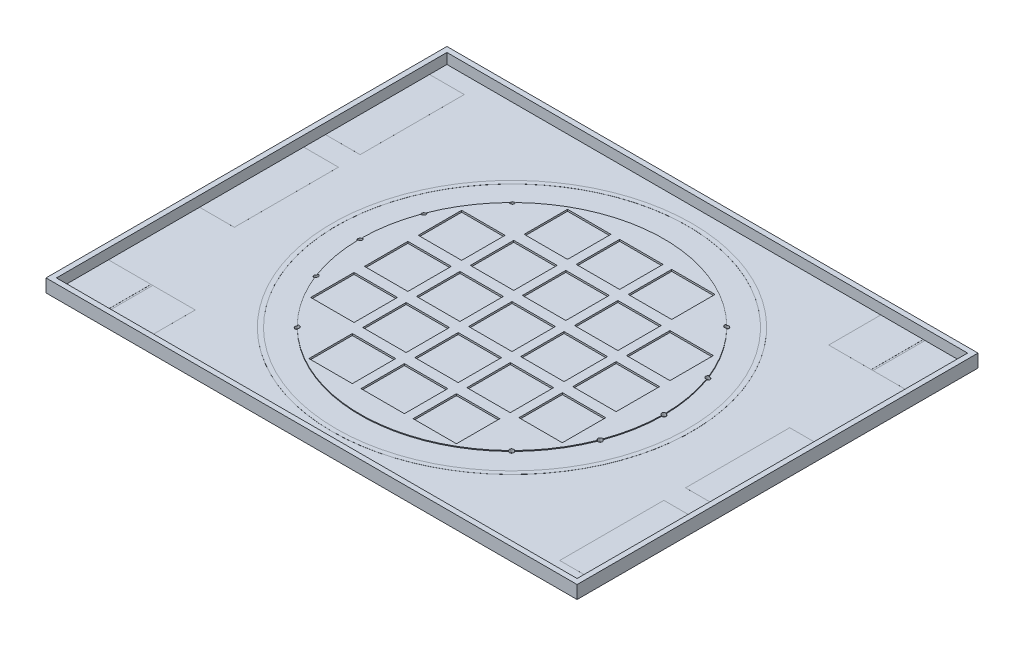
SolidWorks part; units mm, degrees
ref_plane "Front Plane" through (0, 0, 0) normal (0, 0, 1) x (1, 0, 0)
ref_plane "Top Plane" through (0, 0, 0) normal (0, 1, 0) x (1, 0, 0)
ref_plane "Right Plane" through (0, 0, 0) normal (1, 0, 0) x (0, 0, -1)
sketch "Sketch1" plane through (0, 0, 0) normal (0, 1, 0) x (1, 0, 0)
  line L1 (3060, -2310) -> (-3060, -2310)
  line L2 (3060, -2310) -> (3060, 2310)
  line L3 (3060, 2310) -> (-3060, 2310)
  line L4 (-3060, -2310) -> (-3060, 2310)
  line L5 (3060, -2310) -> (-3060, 2310) construction
  line L6 (3060, 2310) -> (-3060, -2310) construction
  point P0 (0, 0)
  dimension "D1" = 4620
  dimension "D2" = 6120
extrude "Boss-Extrude1" add sketch "Sketch1" along normal blind 30
sketch "Sketch2" plane through (0, 30, 0) normal (0, 1, 0) x (1, 0, 0)
  line L0 (3060, -2310) -> (3060, 2310) construction
  line L1 (-3060, -2310) -> (3060, -2310) construction
  line L2 (-3060, 2310) -> (-3060, -2310) construction
  line L3 (3060, 2310) -> (-3060, 2310) construction
  line L4 (3060, -2310) -> (3060, 2310)
  line L5 (-3060, -2310) -> (3060, -2310)
  line L6 (-3060, 2310) -> (-3060, -2310)
  line L7 (3060, 2310) -> (-3060, 2310)
  line L8 (3000, 2250) -> (-3000, 2250)
  line L9 (-3000, 2250) -> (-3000, -2250)
  line L10 (-3000, -2250) -> (3000, -2250)
  line L11 (3000, -2250) -> (3000, 2250)
  dimension "D1" = 60
extrude "Boss-Extrude2" add sketch "Sketch2" along normal blind 120
sketch "Sketch3" plane through (0, 30, 0) normal (0, 1, 0) x (1, 0, 0)
  circle A0 centre (0, 0) radius 1750
  dimension "D1" = 3500
extrude "Boss-Extrude3" add sketch "Sketch3" along normal blind 10
sketch "Sketch4" plane through (0, 40, 0) normal (0, 1, 0) x (1, 0, 0)
  line L0 (0, 1750) -> (0, -1750) construction
  line L1 (350, -250) -> (850, -250)
  line L2 (-250, -250) -> (250, -250)
  line L3 (-250, -250) -> (-250, 250)
  line L4 (-250, 250) -> (250, 250)
  line L5 (250, -250) -> (250, 250)
  line L6 (-250, -250) -> (250, 250) construction
  line L7 (-250, 250) -> (250, -250) construction
  line L8 (350, -250) -> (350, 250)
  line L9 (350, 250) -> (850, 250)
  line L10 (850, -250) -> (850, 250)
  line L11 (950, -250) -> (1450, -250)
  line L12 (950, -250) -> (950, 250)
  line L13 (950, 250) -> (1450, 250)
  line L14 (1450, -250) -> (1450, 250)
  line L15 (-1450, -250) -> (-1450, 250)
  line L16 (-950, 250) -> (-1450, 250)
  line L17 (-950, -250) -> (-950, 250)
  line L18 (-950, -250) -> (-1450, -250)
  line L19 (-850, -250) -> (-850, 250)
  line L20 (-350, 250) -> (-850, 250)
  line L21 (-350, -250) -> (-350, 250)
  line L22 (-350, -250) -> (-850, -250)
  line L23 (-250, 870) -> (250, 870)
  line L24 (250, 370) -> (250, 870)
  line L25 (-250, 370) -> (250, 370)
  line L26 (-250, 370) -> (-250, 870)
  line L27 (-350, 870) -> (-850, 870)
  line L28 (-350, 370) -> (-350, 870)
  line L29 (-350, 370) -> (-850, 370)
  line L30 (-850, 370) -> (-850, 870)
  line L31 (350, 870) -> (850, 870)
  line L32 (350, 370) -> (350, 870)
  line L33 (350, 370) -> (850, 370)
  line L34 (850, 370) -> (850, 870)
  line L35 (-250, 1490) -> (250, 1490)
  line L36 (250, 990) -> (250, 1490)
  line L37 (-250, 990) -> (250, 990)
  line L38 (-250, 990) -> (-250, 1490)
  line L39 (-350, 1490) -> (-850, 1490)
  line L40 (-350, 990) -> (-350, 1490)
  line L41 (-350, 990) -> (-850, 990)
  line L42 (-850, 990) -> (-850, 1490)
  line L43 (350, 1490) -> (850, 1490)
  line L44 (350, 990) -> (350, 1490)
  line L45 (350, 990) -> (850, 990)
  line L46 (850, 990) -> (850, 1490)
  line L47 (-1750, 0) -> (1750, 0) construction
  line L48 (850, -990) -> (850, -1490)
  line L49 (350, -990) -> (850, -990)
  line L50 (350, -990) -> (350, -1490)
  line L51 (350, -1490) -> (850, -1490)
  line L52 (-850, -990) -> (-850, -1490)
  line L53 (-350, -990) -> (-850, -990)
  line L54 (-350, -990) -> (-350, -1490)
  line L55 (-350, -1490) -> (-850, -1490)
  line L56 (-250, -990) -> (-250, -1490)
  line L57 (-250, -990) -> (250, -990)
  line L58 (250, -990) -> (250, -1490)
  line L59 (-250, -1490) -> (250, -1490)
  line L60 (850, -370) -> (850, -870)
  line L61 (350, -370) -> (850, -370)
  line L62 (350, -370) -> (350, -870)
  line L63 (350, -870) -> (850, -870)
  line L64 (-850, -370) -> (-850, -870)
  line L65 (-350, -370) -> (-850, -370)
  line L66 (-350, -370) -> (-350, -870)
  line L67 (-350, -870) -> (-850, -870)
  line L68 (-250, -370) -> (-250, -870)
  line L69 (-250, -370) -> (250, -370)
  line L70 (250, -370) -> (250, -870)
  line L71 (-250, -870) -> (250, -870)
  line L72 (-950, 870) -> (-1450, 870)
  line L73 (-1450, 370) -> (-1450, 870)
  line L74 (-950, 370) -> (-1450, 370)
  line L75 (-950, 370) -> (-950, 870)
  line L76 (950, 870) -> (1450, 870)
  line L77 (950, 370) -> (950, 870)
  line L78 (950, 370) -> (1450, 370)
  line L79 (1450, 370) -> (1450, 870)
  line L80 (1450, -370) -> (1450, -870)
  line L81 (950, -370) -> (1450, -370)
  line L82 (950, -370) -> (950, -870)
  line L83 (950, -870) -> (1450, -870)
  line L84 (-950, -370) -> (-950, -870)
  line L85 (-950, -370) -> (-1450, -370)
  line L86 (-1450, -370) -> (-1450, -870)
  line L87 (-950, -870) -> (-1450, -870)
  circle A0 centre (0, 0) radius 1750 construction
  circle A1 centre (0, 0) radius 1750 construction
  point P7 (0, 0)
  dimension "D4" = 500
  dimension "D1" = 3
  dimension "D2" = 3
  dimension "D3" = 2
extrude "Cut-Extrude1" cut sketch "Sketch4" against normal blind 20
sketch "Sketch12" plane through (0, 30, 0) normal (0, 1, 0) x (1, 0, 0)
  circle A0 centre (0, 0) radius 2050 construction
  circle A1 centre (0, 0) radius 2075
  circle A2 centre (0, 0) radius 2025
  dimension "D1" = 25
  dimension "D3" = 4100
  dimension "D2" = 25
extrude "Boss-Extrude8" add sketch "Sketch12" along normal blind 1
sketch "Sketch13" plane through (0, 30, 0) normal (0, 1, 0) x (1, 0, 0)
  line L0 (-3000, 2250) -> (-3000, -2250) construction
  line L1 (-3000, -1650) -> (-2000, -1650)
  line L2 (-3000, -1650) -> (-3000, -2250)
  line L3 (-3000, -2250) -> (-2000, -2250)
  line L4 (-2000, -1650) -> (-2000, -2250)
  line L5 (-3000, -2250) -> (3000, -2250) construction
  line L6 (-3000, 0) -> (3000, 0) construction
  line L7 (3000, -2250) -> (3000, 2250) construction
  line L8 (3000, 2250) -> (-3000, 2250) construction
  line L9 (-3000, 600) -> (-2600, 600)
  line L10 (-3000, 600) -> (-3000, -600)
  line L11 (-3000, -600) -> (-2600, -600)
  line L12 (-2600, 600) -> (-2600, -600)
  line L13 (-3000, 2050) -> (-2600, 2050)
  line L14 (-3000, 2050) -> (-3000, 850)
  line L15 (-3000, 850) -> (-2600, 850)
  line L16 (-2600, 2050) -> (-2600, 850)
  line L29 (0, 2250) -> (0, -2250) construction
  line L30 (-3000, -2250) -> (3000, -2250) construction
  line L31 (3000, 1650) -> (2000, 1650)
  line L32 (3000, 1650) -> (3000, 2250)
  line L33 (3000, 2250) -> (2000, 2250)
  line L34 (2000, 1650) -> (2000, 2250)
  line L35 (3000, -600) -> (2600, -600)
  line L36 (3000, -600) -> (3000, 600)
  line L37 (3000, 600) -> (2600, 600)
  line L38 (2600, -600) -> (2600, 600)
  line L39 (3000, -2050) -> (2600, -2050)
  line L40 (3000, -2050) -> (3000, -850)
  line L41 (3000, -850) -> (2600, -850)
  line L42 (2600, -2050) -> (2600, -850)
  point P37 (0, 0)
  point P43 (0, 0)
  dimension "D1" = 1000
  dimension "D2" = 600
  dimension "D3" = 1200
  dimension "D4" = 400
  dimension "D5" = 400
  dimension "D6" = 1200
  dimension "D7" = 200
  dimension "D8" = 2
extrude "Boss-Extrude9" add sketch "Sketch13" along normal blind 0.1
sketch "Sketch14" plane through (0, 40, 0) normal (0, 1, 0) x (1, 0, 0)
  line L0 (-850, -1240) -> (-1234.8684, -1240) construction
  line L1 (-850, -990) -> (-850, -1490) construction
  line L2 (-1450, -620) -> (-1636.4901, -620) construction
  line L3 (-1450, -370) -> (-1450, -870) construction
  line L5 (0, 0) -> (-1234.8684, -1240) construction
  line L6 (0, 0) -> (-1636.4901, -620) construction
  line L7 (0, 0) -> (-1750, 0) construction
  line L8 (-1450, 620) -> (-1636.4901, 620) construction
  line L9 (-1450, 870) -> (-1450, 370) construction
  line L10 (-850, 1240) -> (-1234.8684, 1240) construction
  line L11 (-850, 1490) -> (-850, 990) construction
  line L12 (0, 2250) -> (0, -2250) construction
  line L13 (3000, 2250) -> (-3000, 2250) construction
  line L14 (-3000, -2250) -> (3000, -2250) construction
  line L15 (850, 1240) -> (1234.8684, 1240) construction
  line L16 (1450, 620) -> (1636.4901, 620) construction
  line L17 (1450, -620) -> (1636.4901, -620) construction
  line L18 (850, -1240) -> (1234.8684, -1240) construction
  circle A1 centre (-1636.4901, -620) radius 25
  circle A4 centre (0, 0) radius 1750 construction
  circle A5 centre (-1234.8684, -1240) radius 25
  circle A6 centre (0, 0) radius 1750 construction
  circle A7 centre (-1750, 0) radius 25
  circle A8 centre (-1636.4901, 620) radius 25
  circle A9 centre (-1234.8684, 1240) radius 25
  circle A10 centre (1234.8684, 1240) radius 25
  circle A11 centre (1636.4901, 620) radius 25
  circle A12 centre (1750, 0) radius 25
  circle A13 centre (1234.8684, -1240) radius 25
  circle A14 centre (1636.4901, -620) radius 25
  dimension "D1" = 50
extrude "Cut-Extrude2" cut sketch "Sketch14" against normal blind 40
sketch "Sketch15" plane through (0, 30.1, 0) normal (0, 1, 0) x (1, 0, 0)
  line L0 (-2500, -1650) -> (-2500, -2250) construction
  line L1 (-2000, -1650) -> (-3000, -1650) construction
  line L2 (-3000, -2250) -> (-2000, -2250) construction
  line L3 (-3000, -2250) -> (3000, -2250) construction
  line L4 (-2510, -1650) -> (-2490, -1650)
  line L5 (-2510, -1650) -> (-2510, -2250)
  line L6 (-2510, -2250) -> (-2490, -2250)
  line L7 (-2490, -1650) -> (-2490, -2250)
  line L9 (2510, 1650) -> (2510, 2250)
  line L10 (2490, 1650) -> (2490, 2250)
  line L11 (2510, 1650) -> (2490, 1650)
  line L12 (2510, 2250) -> (2490, 2250)
  point P19 (0, 0)
  dimension "D1" = 20
  dimension "D2" = 2
extrude "Cut-Extrude3" cut sketch "Sketch15" against normal blind 1
